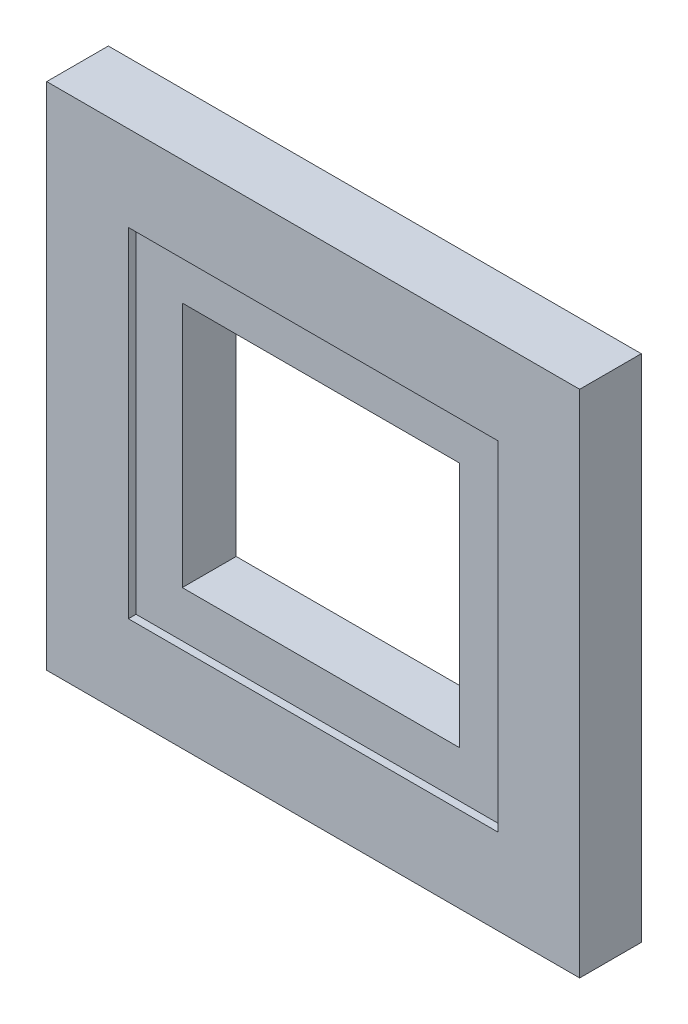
SolidWorks part; units mm, degrees
ref_plane "Front Plane" through (0, 0, 0) normal (0, 0, 1) x (1, 0, 0)
ref_plane "Top Plane" through (0, 0, 0) normal (0, 1, 0) x (1, 0, 0)
ref_plane "Right Plane" through (0, 0, 0) normal (1, 0, 0) x (0, 0, -1)
sketch "Sketch1" plane through (0, 0, 0) normal (0, 0, 1) x (1, 0, 0)
  line L1 (82.55, -77.7875) -> (-82.55, -77.7875)
  line L2 (82.55, -77.7875) -> (82.55, 77.7875)
  line L3 (82.55, 77.7875) -> (-82.55, 77.7875)
  line L4 (-82.55, -77.7875) -> (-82.55, 77.7875)
  line L5 (82.55, -77.7875) -> (-82.55, 77.7875) construction
  line L6 (82.55, 77.7875) -> (-82.55, -77.7875) construction
  point P0 (0, 0)
  dimension "D1" = 155.575
  dimension "D2" = 165.1
extrude "Boss-Extrude1" add sketch "Sketch1" along normal blind 25.4
sketch "Sketch2" plane through (0, 0, 25.4) normal (0, 0, 1) x (1, 0, 0)
  line L1 (76.2, -69.85) -> (-76.2, -69.85)
  line L2 (76.2, -69.85) -> (76.2, 69.85)
  line L3 (76.2, 69.85) -> (-76.2, 69.85)
  line L4 (-76.2, -69.85) -> (-76.2, 69.85)
  line L5 (76.2, -69.85) -> (-76.2, 69.85) construction
  line L6 (76.2, 69.85) -> (-76.2, -69.85) construction
  point P0 (0, 0)
  dimension "D1" = 139.7
  dimension "D2" = 152.4
extrude "Cut-Extrude1" cut sketch "Sketch2" against normal blind 3.175
sketch "Sketch3" plane through (0, 0, 22.225) normal (0, 0, 1) x (1, 0, 0)
  line L1 (57.15, -50.8) -> (-57.15, -50.8)
  line L2 (57.15, -50.8) -> (57.15, 50.8)
  line L3 (57.15, 50.8) -> (-57.15, 50.8)
  line L4 (-57.15, -50.8) -> (-57.15, 50.8)
  line L5 (57.15, -50.8) -> (-57.15, 50.8) construction
  line L6 (57.15, 50.8) -> (-57.15, -50.8) construction
  point P0 (0, 0)
  dimension "D1" = 114.3
  dimension "D2" = 101.6
extrude "Cut-Extrude2" cut sketch "Sketch3" against normal through all
sketch "Sketch4" plane through (0, 0, 25.4) normal (0, 0, 1) x (1, 0, 0)
  line L0 (109.85, 105.0875) -> (-109.85, 105.0875)
  line L1 (-109.85, 105.0875) -> (-109.85, -105.0875)
  line L2 (-109.85, -105.0875) -> (109.85, -105.0875)
  line L3 (109.85, -105.0875) -> (109.85, 105.0875)
  line L4 (-82.55, 77.7875) -> (-82.55, -77.7875)
  line L5 (-82.55, -77.7875) -> (82.55, -77.7875)
  line L6 (82.55, -77.7875) -> (82.55, 77.7875)
  line L7 (82.55, 77.7875) -> (-82.55, 77.7875)
  line L8 (-82.55, 77.7875) -> (-82.55, -77.7875)
  line L9 (-82.55, -77.7875) -> (82.55, -77.7875)
  line L10 (82.55, -77.7875) -> (82.55, 77.7875)
  line L11 (82.55, 77.7875) -> (-82.55, 77.7875)
  dimension "D1" = 0
  dimension "D2" = 27.3
extrude "Boss-Extrude2" add sketch "Sketch4" against normal up to surface (25.4 mm away)
